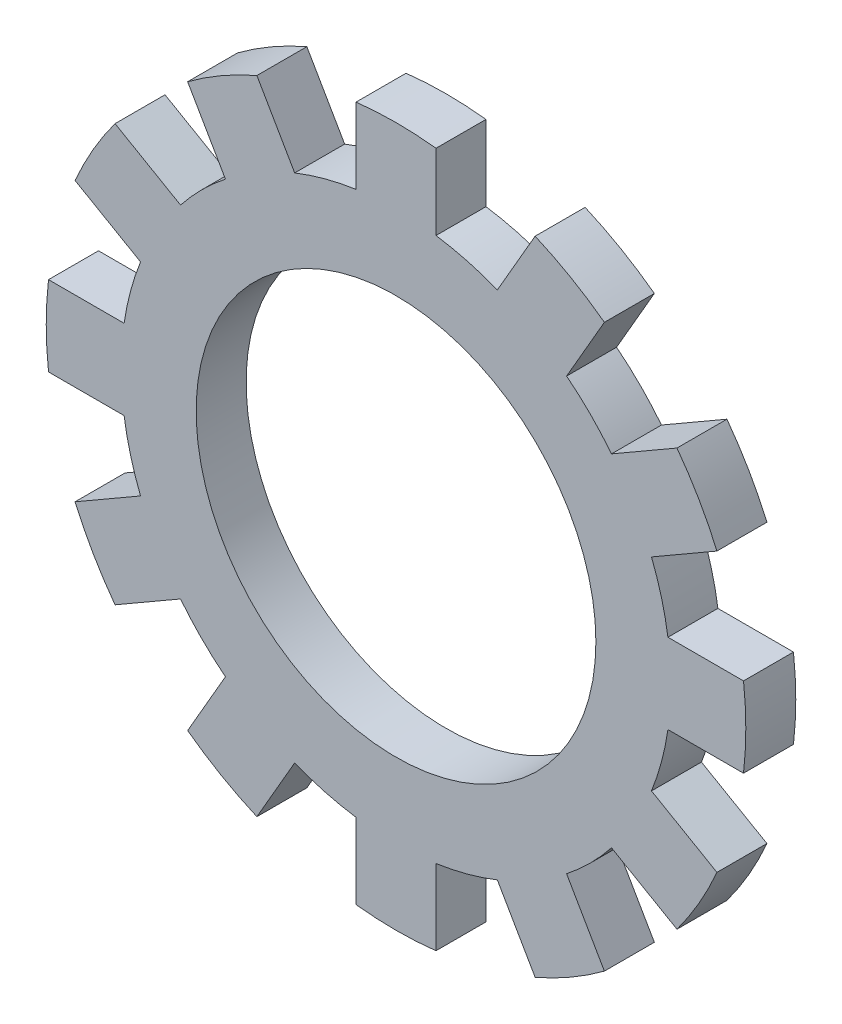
SolidWorks part; units mm, degrees
ref_plane "Front Plane" through (0, 0, 0) normal (0, 0, 1) x (1, 0, 0)
ref_plane "Top Plane" through (0, 0, 0) normal (0, 1, 0) x (1, 0, 0)
ref_plane "Right Plane" through (0, 0, 0) normal (1, 0, 0) x (0, 0, -1)
sketch "Sketch1" plane through (0, 0, 0) normal (0, 0, 1) x (1, 0, 0)
  circle A0 centre (0, 0) radius 2
  circle A1 centre (0, 0) radius 2.75
  dimension "D1" = 4
  dimension "D2" = 5.5
extrude "Boss-Extrude1" add sketch "Sketch1" along normal mid plane 0.5
sketch "Sketch2" plane through (0, 0, 0) normal (0, 0, 1) x (1, 0, 0)
  line L0 (0, 2.6811) -> (0, -2.8425) construction
sketch "Sketch3" plane through (0, 0, 0) normal (0, 0, 1) x (1, 0, 0)
  line L0 (-0.4, 3.4771) -> (-0.4, 2.7208)
  line L2 (0, 2.6811) -> (0, -2.8425) construction
  line L3 (0, 2.75) -> (0, 3.5)
  arc A0 (0, 3.5) -> (-0.4, 3.4771) centre (0, 0) ccw
  arc A1 (0, 2.75) -> (-0.4, 2.7208) centre (0, 0) ccw
  circle A2 centre (0, 0) radius 2.75 construction
  dimension "D2" = 3.5
  dimension "D1" = 0.4
extrude "Boss-Extrude2" add sketch "Sketch3" along normal mid plane 0.5
mirror "Mirror1" about plane through (0, 0, 0) normal (1, 0, 0) of "Boss-Extrude2"
pattern_circular "CirPattern2" count 12 over 360 about axis through (0, 0, 0) along (0, 0, 1) of "Boss-Extrude2", "Mirror1"
